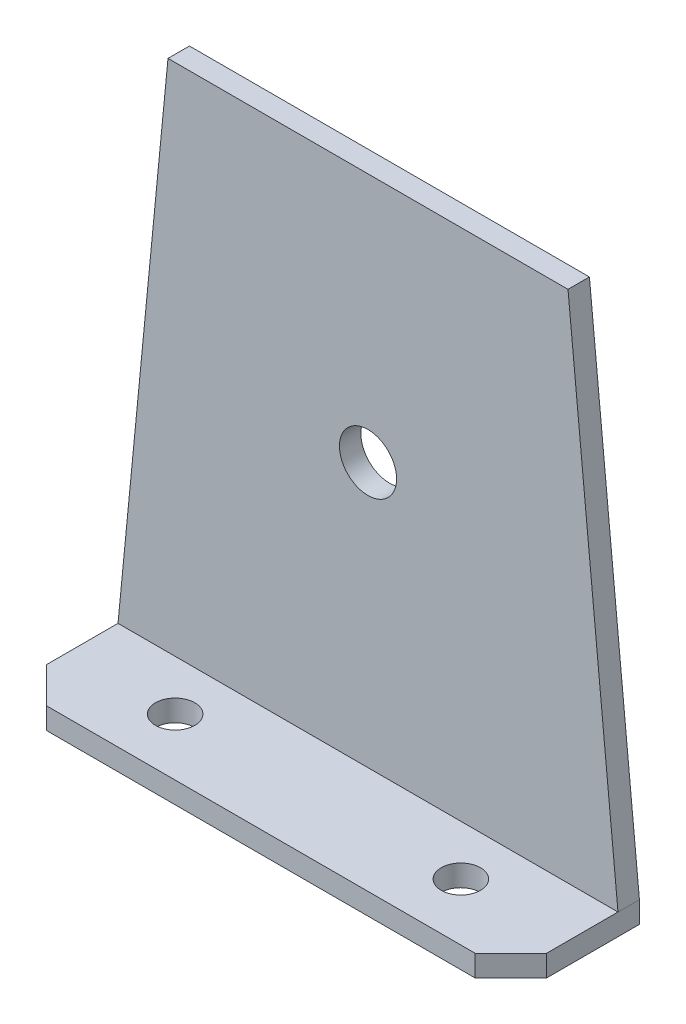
SolidWorks part; units mm, degrees
ref_plane "Front" through (0, 0, 0) normal (0, 0, 1) x (1, 0, 0)
ref_plane "Top" through (0, 0, 0) normal (0, 1, 0) x (1, 0, 0)
ref_plane "Right" through (0, 0, 0) normal (1, 0, 0) x (0, 0, -1)
sketch "Sketch1" plane through (0, 0, 0) normal (1, 0, 0) x (0, 0, -1)
  line L0 (0, 0) -> (-18, 0)
  line L1 (0, 0) -> (0, 75)
  line L2 (-3, 3) -> (-3, 75)
  line L3 (-3, 3) -> (-18, 3)
  line L4 (0, 75) -> (-3, 75)
  line L5 (-18, 3) -> (-18, 0)
  line L6 (0, 3) -> (-18, 3) construction
  line L7 (-3, 0) -> (-3, 75) construction
extrude "Extrude1" add sketch "Sketch1" along normal blind 70
sketch "Sketch2" plane through (0, 0, 3) normal (0, 0, 1) x (1, 0, 0)
  line L6 (63, 75) -> (70, 3)
  line L7 (70, 3) -> (70, 75)
  line L8 (70, 75) -> (63, 75)
  line L9 (7, 75) -> (0, 3)
  line L10 (0, 3) -> (0, 75)
  line L11 (0, 75) -> (7, 75)
  circle A0 centre (35, 40) radius 4
extrude "Cut-Extrude1" cut sketch "Sketch2" against normal blind 70
sketch "Sketch3" plane through (0, 3, 0) normal (0, 1, 0) x (-1, 0, 0)
  circle A0 centre (-55, 10) radius 2.75
  circle A1 centre (-15, 10) radius 2.75
extrude "Cut-Extrude2" cut sketch "Sketch3" against normal blind 70
chamfer "Chamfer1" distance 5 2 edges at (70, 1.5, 18) (0, 1.5, 18)
